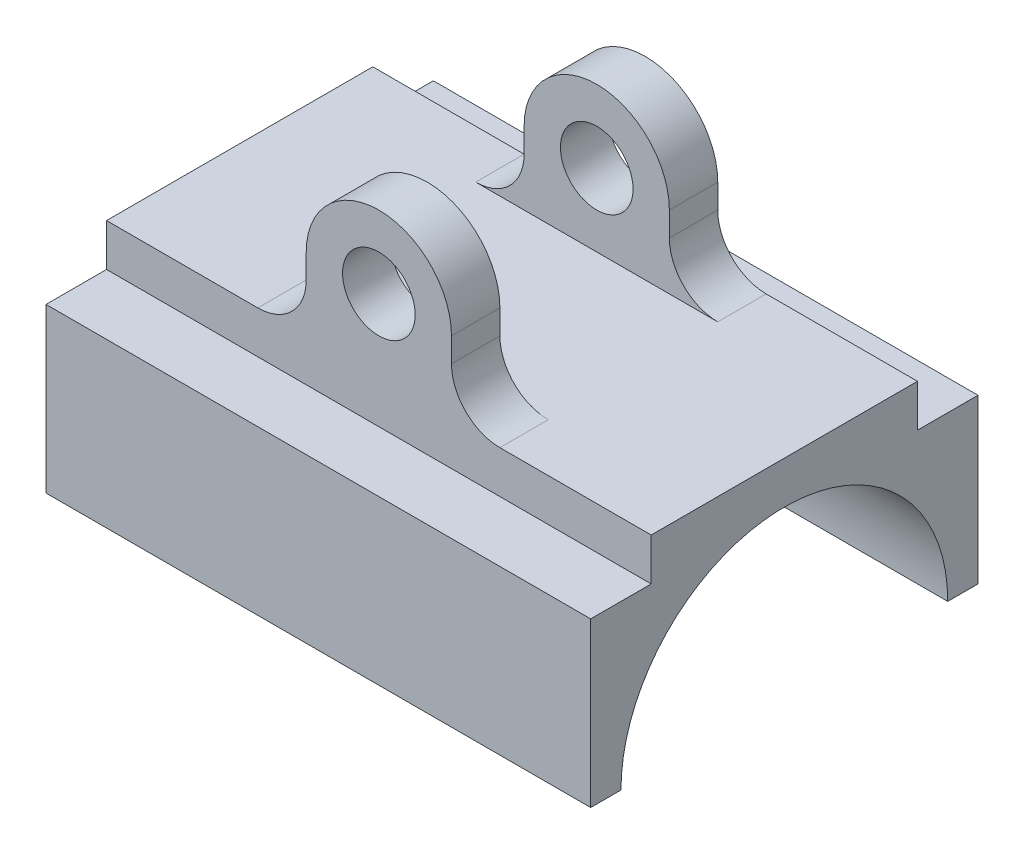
SolidWorks part; units mm, degrees
ref_plane "Front" through (0, 0, 0) normal (0, 0, 1) x (1, 0, 0)
ref_plane "Top" through (0, 0, 0) normal (0, 1, 0) x (1, 0, 0)
ref_plane "Right" through (0, 0, 0) normal (1, 0, 0) x (0, 0, -1)
sketch "Sketch1" plane through (0, 0, 0) normal (1, 0, 0) x (0, 0, -1)
  line L0 (-85.725, 0) -> (-101.6, 0)
  line L1 (-101.6, 0) -> (-101.6, 85.725)
  line L2 (-101.6, 85.725) -> (-69.85, 85.725)
  line L3 (-69.85, 85.725) -> (-69.85, 107.95)
  line L4 (-69.85, 107.95) -> (69.85, 107.95)
  line L5 (69.85, 107.95) -> (69.85, 85.725)
  line L6 (69.85, 85.725) -> (101.6, 85.725)
  line L7 (101.6, 85.725) -> (101.6, 0)
  line L8 (101.6, 0) -> (85.725, 0)
  line L9 (0, 0) -> (0, 107.95) construction
  arc A0 (-85.725, 0) -> (85.725, 0) centre (0, 0) cw
  dimension "D1" = 171.45
  dimension "D2" = 203.2
  dimension "D3" = 85.725
  dimension "D4" = 22.225
  dimension "D5" = 139.7
extrude "Base-Extrude" add sketch "Sketch1" against normal blind 285.75
sketch "Sketch2" plane through (0, 0, 69.85) normal (0, 0, 1) x (1, 0, 0)
  line L0 (-180.975, 107.95) -> (-180.975, 146.05)
  line L1 (-285.75, 107.95) -> (0, 107.95) construction
  line L2 (-104.775, 146.05) -> (-104.775, 107.95)
  line L3 (-104.775, 107.95) -> (-180.975, 107.95)
  line L4 (-142.875, 146.05) -> (-142.875, 0) construction
  line L5 (-285.75, 0) -> (0, 0) construction
  arc A0 (-180.975, 146.05) -> (-104.775, 146.05) centre (-142.875, 146.05) cw
  dimension "D1" = 38.1
  dimension "D2" = 38.1
extrude "Boss-Extrude1" add sketch "Sketch2" against normal blind 25.4
fillet "Fillet1" radius 25.4 2 edges at (-104.775, 107.95, 57.15) (-180.975, 107.95, 57.15)
sketch "Sketch3" plane through (0, 0, 69.85) normal (0, 0, 1) x (1, 0, 0)
  circle A0 centre (-142.875, 146.05) radius 19.05
  dimension "D1" = 38.1
extrude "Cut-Extrude1" cut sketch "Sketch3" against normal up to surface (25.4 mm away)
mirror "Mirror1" about plane through (0, 0, 0) normal (0, 0, 1) of "Boss-Extrude1", "Fillet1", "Cut-Extrude1"
